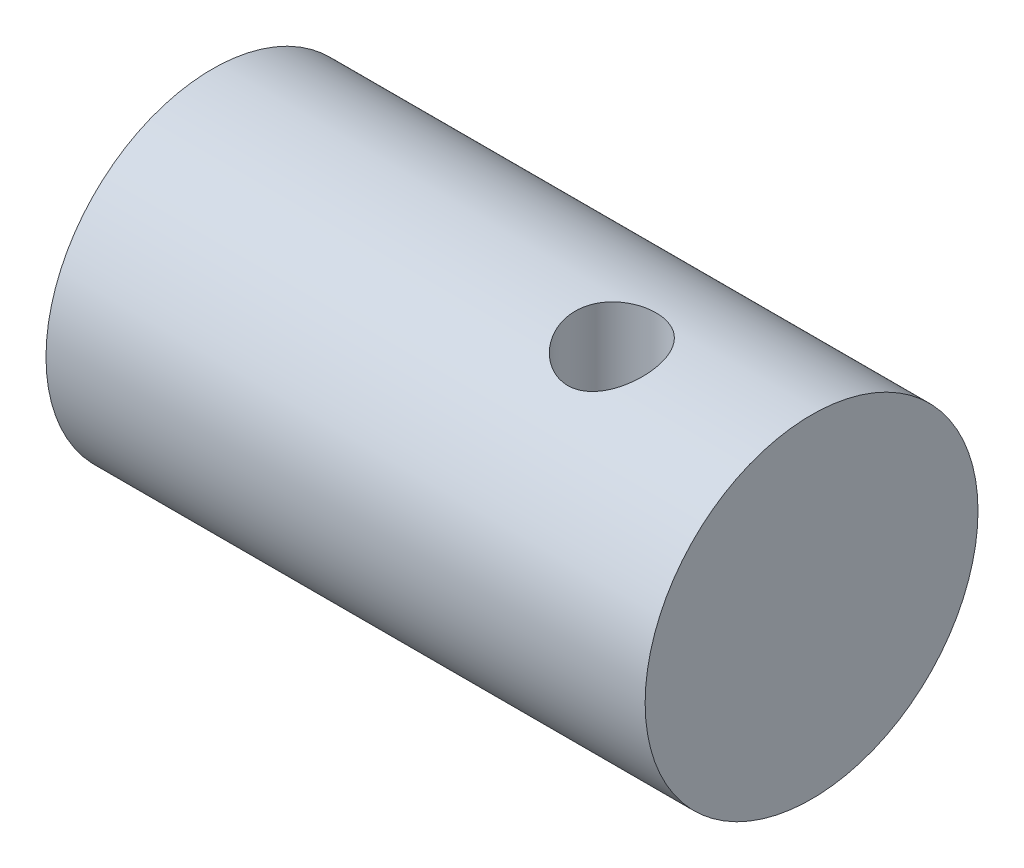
SolidWorks part; units mm, degrees
ref_plane "Front Plane" through (0, 0, 0) normal (0, 0, 1) x (1, 0, 0)
ref_plane "Top Plane" through (0, 0, 0) normal (0, 1, 0) x (1, 0, 0)
ref_plane "Right Plane" through (0, 0, 0) normal (1, 0, 0) x (0, 0, -1)
sketch "Sketch1" plane through (0, 0, 0) normal (0, 0, 1) x (1, 0, 0)
  line L0 (0, 0) -> (71.0886, 0) construction
  line L1 (0, 0) -> (-5.08, 0)
  line L2 (0, 0) -> (0, 15.875)
  line L3 (0, 15.875) -> (-57.15, 15.875)
  line L4 (-57.15, 15.875) -> (-57.15, 12.7)
  line L5 (-57.15, 12.7) -> (-50.8, 12.7)
  line L6 (-50.8, 12.7) -> (-50.8, 10.3124)
  line L7 (-50.8, 10.3124) -> (-31.75, 10.3124)
  line L8 (-31.75, 10.3124) -> (-31.75, 6.5405)
  line L9 (-31.75, 6.5405) -> (-5.08, 6.5405)
  line L10 (-5.08, 6.5405) -> (-5.08, 0)
other "AlignGroup1" parameters "D1"=38.3112, "D2"=71.0886, "D3"=71.0886, "D4"=71.0886, "D5"=0, "D6"=6.35, "D7"=25.4, "D8"=52.07, "D9"=57.15
revolve "Revolve1" add sketch "Sketch1" angle 360 about L0
sketch "Sketch2" plane through (0, 0, 0) normal (0, 1, 0) x (1, 0, 0)
  line L0 (-57.15, 15.875) -> (-57.15, -15.875) construction
  circle A0 centre (-15.875, -3.175) radius 4.2164
  dimension "D2" = 8.4328
  dimension "D1" = 41.275
  dimension "D3" = 3.175
extrude "Extrude1" cut sketch "Sketch2" against normal through all and the other way through all
